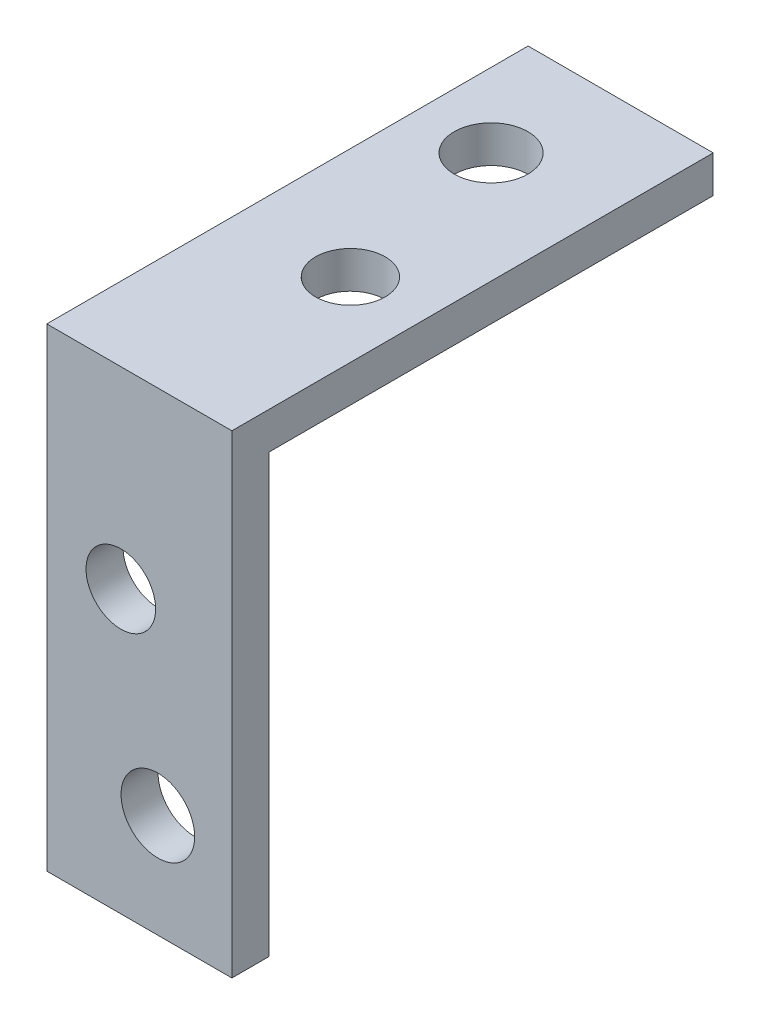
SolidWorks part; units mm, degrees
ref_plane "Front" through (0, 0, 0) normal (0, 0, 1) x (1, 0, 0)
ref_plane "Top" through (0, 0, 0) normal (0, 1, 0) x (1, 0, 0)
ref_plane "Right" through (0, 0, 0) normal (1, 0, 0) x (0, 0, -1)
sketch "Sketch1" plane through (0, 0, 0) normal (0, 1, 0) x (1, 0, 0)
  line L1 (0, 41.275) -> (15.875, 41.275)
  line L2 (0, 41.275) -> (0, 0)
  line L3 (0, 0) -> (15.875, 0)
  line L4 (15.875, 41.275) -> (15.875, 0)
  circle A0 centre (9.525, 16.51) radius 2.9845
  circle A1 centre (6.35, 31.75) radius 3.1578
  dimension "D3" = 5.969
  dimension "D1" = 15.875
  dimension "D2" = 41.275
  dimension "D4" = 6.35
  dimension "D5" = 6.35
  dimension "D6" = 16.51
  dimension "D7" = 31.75
extrude "Extrude1" add sketch "Sketch1" along normal blind 3.175
sketch "Sketch3" plane through (0, 0, 0) normal (0, 0, 1) x (1, 0, 0)
  line L0 (15.875, -37.465) -> (0, -37.465)
  line L1 (15.875, -37.465) -> (15.875, 3.175)
  line L2 (15.875, 3.175) -> (0, 3.175)
  line L3 (0, -37.465) -> (0, 3.175)
  circle A0 centre (6.35, -13.335) radius 2.9845
  circle A1 centre (9.525, -28.575) radius 3.1578
  dimension "D3" = 5.969
  dimension "D1" = 15.875
  dimension "D2" = 40.64
  dimension "D4" = 6.35
  dimension "D5" = 6.35
  dimension "D6" = 16.51
  dimension "D7" = 31.75
extrude "Extrude2" add sketch "Sketch3" against normal blind 3.175
